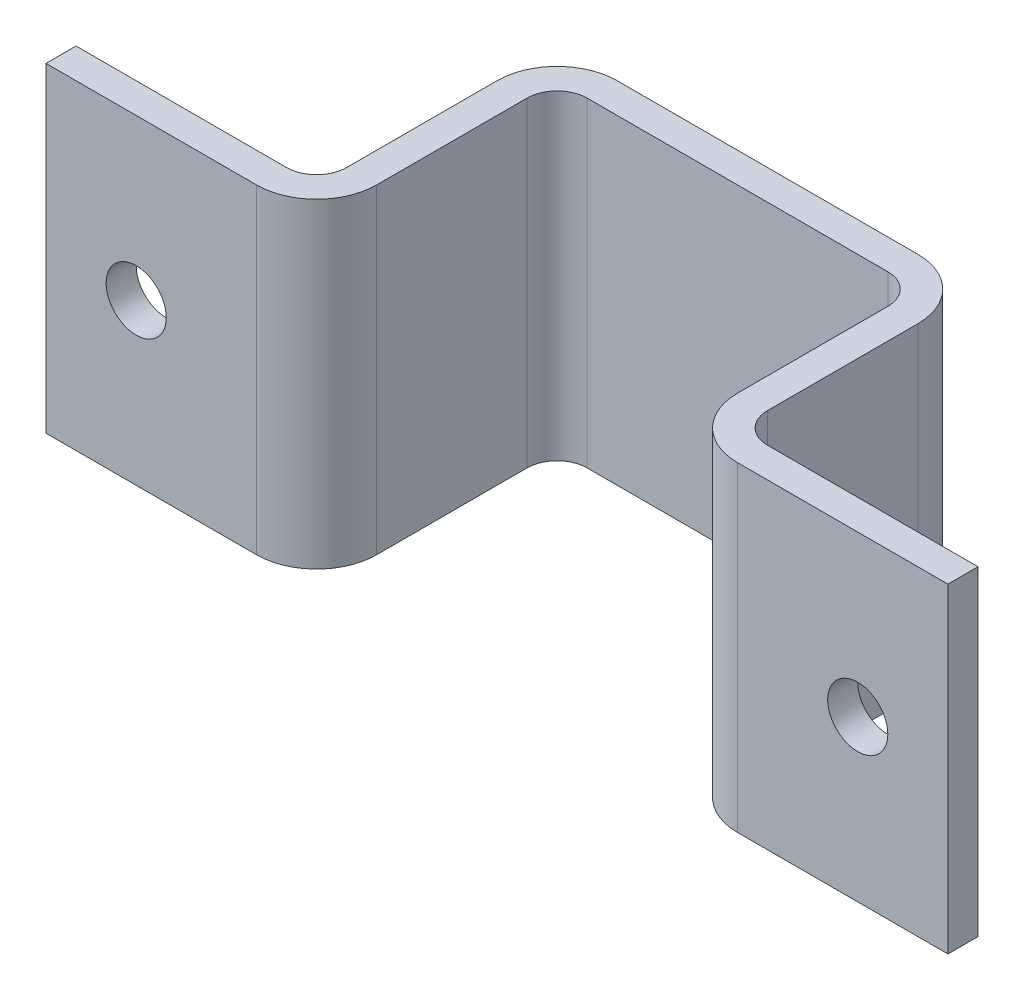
SolidWorks part; units mm, degrees
ref_plane "Front" through (0, 0, 0) normal (0, 0, 1) x (1, 0, 0)
ref_plane "Top" through (0, 0, 0) normal (0, 1, 0) x (1, 0, 0)
ref_plane "Right" through (0, 0, 0) normal (1, 0, 0) x (0, 0, -1)
mirrored part "support_Mirrored"
other "<support>-<LPattern1>"
